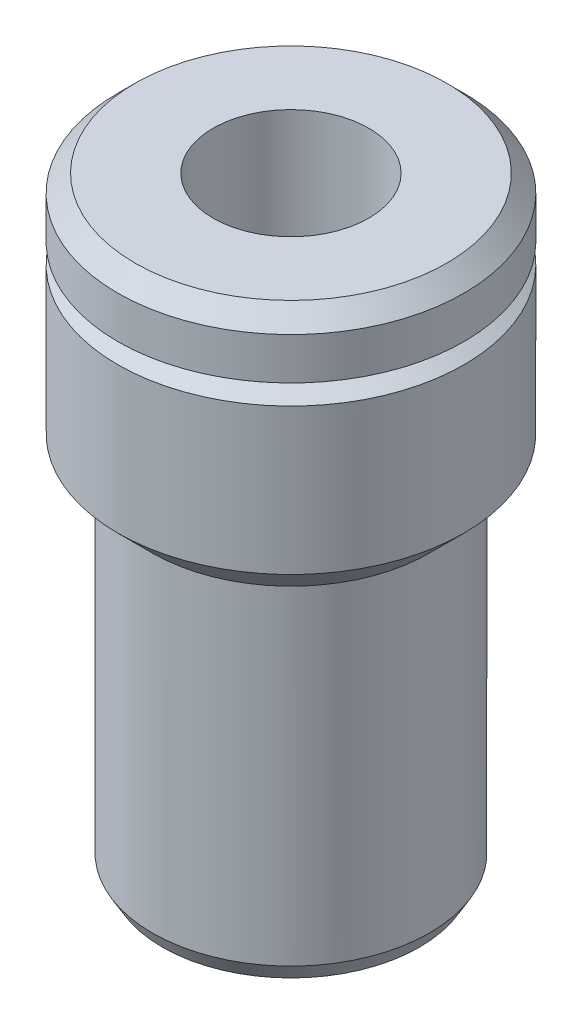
SolidWorks part; units mm, degrees
ref_plane "Plan1" through (0, 0, 0) normal (0, 0, 1) x (1, 0, 0)
ref_plane "Plan2" through (0, 0, 0) normal (0, 1, 0) x (1, 0, 0)
ref_plane "Plan3" through (0, 0, 0) normal (1, 0, 0) x (0, 0, -1)
sketch "Esquisse1" plane through (0, 0, 0) normal (0, 0, 1) x (1, 0, 0)
  line L0 (0, 25.7125) -> (0, -24.225) construction
  line L1 (4.5, 15) -> (10, 15)
  line L2 (10, 15) -> (10, 11.5774)
  line L3 (10, 0) -> (8, 0)
  line L4 (8, 0) -> (8, -20)
  line L5 (8, -20) -> (4.5, -20)
  line L6 (4.5, -20) -> (4.5, 15)
  line L7 (10, 11.5774) -> (9, 11)
  line L8 (9, 11) -> (10, 10.4226)
  line L9 (10, 10.4226) -> (10, 0)
  line L10 (4.9716, 11) -> (8.6535, 11) construction
  dimension "D1" = 4.5
  dimension "D2" = 15
  dimension "D3" = 20
  dimension "D4" = 8
  dimension "D5" = 10
  dimension "D6" = 60
  dimension "D7" = 4
  dimension "D8" = 1
revolve "Base-Révolution" add sketch "Esquisse1" angle 360 about L0
chamfer "Chanfrein1" distance 1 angle 45
chamfer "Chanfrein2" distance 1 angle 30
chamfer "Chanfrein3" distance 2 angle 45
